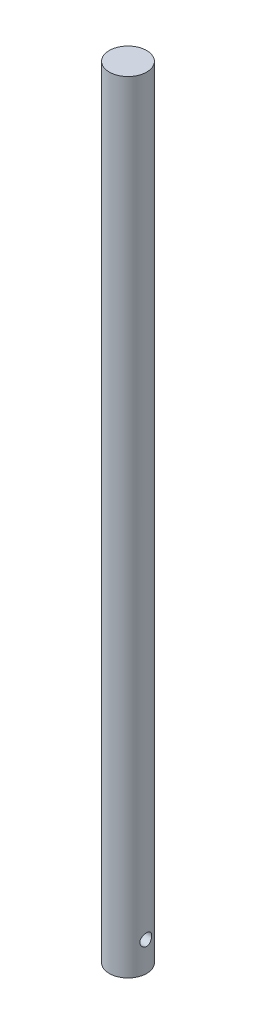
SolidWorks part; units mm, degrees
ref_plane "Front Plane" through (0, 0, 0) normal (0, 0, 1) x (1, 0, 0)
ref_plane "Top Plane" through (0, 0, 0) normal (0, 1, 0) x (1, 0, 0)
ref_plane "Right Plane" through (0, 0, 0) normal (1, 0, 0) x (0, 0, -1)
sketch "Sketch1" plane through (0, 0, 0) normal (0, 1, 0) x (1, 0, 0)
  circle A0 centre (0, 0) radius 12.7
  dimension "D1" = 25.4
extrude "Extrude1" add sketch "Sketch1" along normal blind 530
sketch "Sketch2" plane through (0, 0, 0) normal (1, 0, 0) x (0, 0, -1)
  line L0 (0, 600) -> (0, 0) construction
  circle A0 centre (0, 20) radius 4
  dimension "D1" = 8
  dimension "D2" = 20
extrude "Cut-Extrude1" cut sketch "Sketch2" against normal up to surface and the other way up to surface
